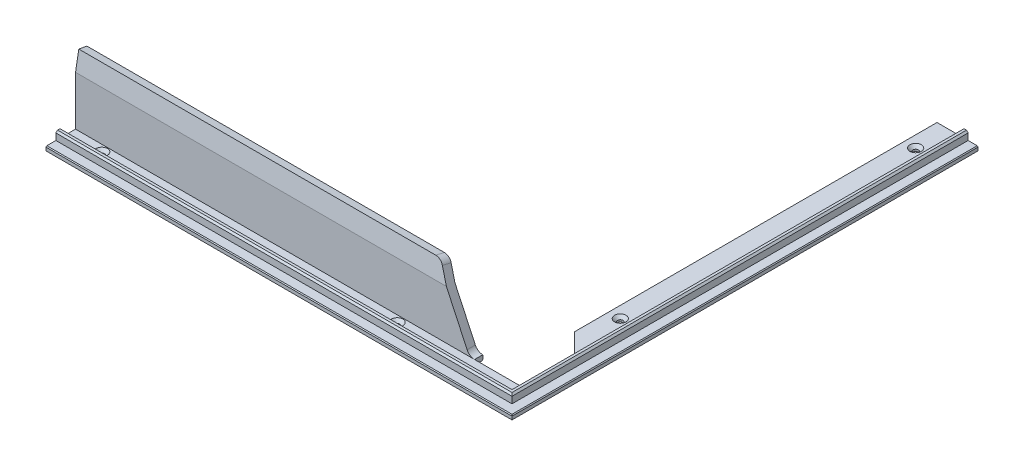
SolidWorks part; units mm, degrees
other "<Ecke Haubenauflage>-<Verrundung1>"
ref_plane "Ebene vorne" through (0, 0, 0) normal (0, 0, 1) x (1, 0, 0)
ref_plane "Ebene oben" through (0, 0, 0) normal (0, 1, 0) x (1, 0, 0)
ref_plane "Ebene rechts" through (0, 0, 0) normal (1, 0, 0) x (0, 0, -1)
ref_plane "Ebene vorne-Ecke Haubenauflage_Gespiegelt" through (450, 0, 0) normal (0, 0, 1) x (-1, 0, 0)
ref_plane "Ebene oben-Ecke Haubenauflage_Gespiegelt" through (450, 0, 0) normal (0, 1, 0) x (-1, 0, 0)
ref_plane "Ebene rechts-Ecke Haubenauflage_Gespiegelt" through (450, 0, 0) normal (-1, 0, 0) x (0, 0, -1)
mirrored part "Ecke Haubenauflage_Gespiegelt" parameters "D1.Aufsatz-Linear austragen1"=3, "D1.Skizze1"=23, "D2.Skizze1"=284, "D3.Skizze1"=284, "D1.Aufsatz-Linear austragen2"=5, "D1.Skizze2"=6, "D2.Skizze2"=3, "D3.Skizze2"=6, "D1.Fase1"=0.5, "D2.Fase1"=45, "D1.Fase2"=1, "D2.Fase2"=45, "Bohrerdurchmesser.Skizze4"=3.4, "Bohrungstiefe.Skizze4"=3, "Senkdurchmesser (Oben).Skizze4"=7, "Senkwinkel (Oben).Skizze4"=90, "D1.Skizze3"=14, "D2.Skizze3"=18, "D4.Skizze3"=180, "D5.Skizze3"=180, "D6.Skizze3"=20, "D3.Skizze3"=20, "D1.Aufsatz-Linear austragen3"=240, "D1.Skizze5"=30, "D2.Skizze5"=5, "D3.Skizze5"=5, "D4.Skizze5"=11, "D5.Skizze5"=170, "D1.Skizze6"=25, "D1.Verrundung1"=5, "D4.Skizze1"=25
sketch "Skizze1" plane through (0, 3, 0) normal (0, 1, 0) x (1, 0, 0)
  line L0 (502.1854, 0) -> (502.1854, -5)
  line L1 (502.1854, 0) -> (518, 0) construction
  line L2 (502.1854, -5) -> (534, -5)
  line L3 (534, -5) -> (534, 24)
  line L4 (534, 24) -> (518, 40)
  line L6 (518, 40) -> (518, 0)
  line L7 (518, 0) -> (502.1854, 0)
  line L8 (502.1854, 0) -> (518, 0) construction
  line L9 (518, 0) -> (518, 261) construction
  dimension "D1" = 45
  dimension "D4" = 40
  dimension "D5" = 16
  dimension "D6" = 5
extrude "Schnitt-Linear austragen1" cut sketch "Skizze1" against normal through all
